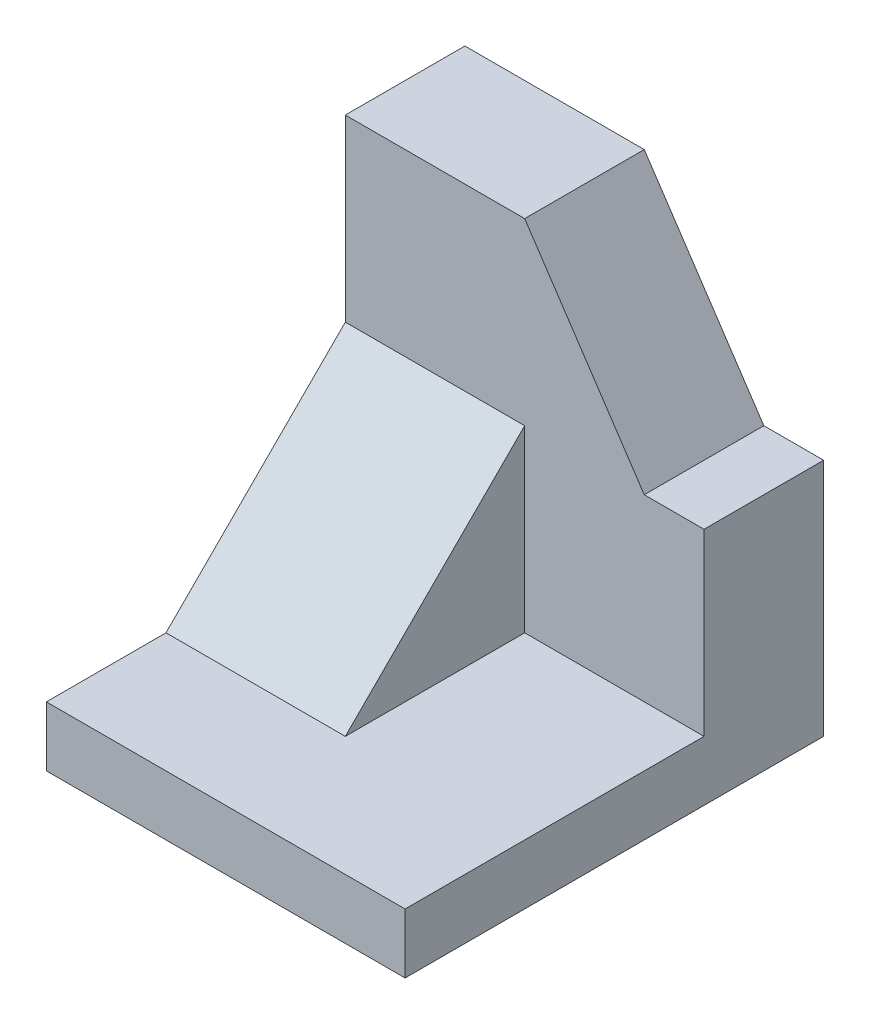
SolidWorks part; units mm, degrees
ref_plane "Alzado" through (0, 0, 0) normal (0, 0, 1) x (1, 0, 0)
ref_plane "Planta" through (0, 0, 0) normal (0, 1, 0) x (1, 0, 0)
ref_plane "Vista lateral" through (0, 0, 0) normal (1, 0, 0) x (0, 0, -1)
sketch "Croquis1" plane through (0, 0, 0) normal (0, 0, 1) x (1, 0, 0)
  line L0 (30, 35) -> (-30, -35) construction
  line L1 (-30, 35) -> (30, 35)
  line L2 (-30, 35) -> (-30, -35)
  line L3 (-30, -35) -> (30, -35)
  line L4 (30, 35) -> (30, -35)
  line L5 (30, -35) -> (-30, 35) construction
  dimension "D1" = 70
  dimension "D2" = 60
extrude "Saliente-Extruir1" add sketch "Croquis1" along normal mid plane 70
sketch "Croquis2" plane through (0, 0, 0) normal (1, 0, 0) x (0, 0, -1)
  line L0 (-35, -25) -> (-15, -25)
  line L1 (-35, 35) -> (35, 35) construction
  line L2 (15, 35) -> (15, 5)
  line L3 (-35, -35) -> (-35, 35) construction
  line L4 (-15, -25) -> (15, 5)
  line L5 (15, 35) -> (-35, 35)
  line L6 (-35, 35) -> (-35, -25)
  line L7 (-35, -35) -> (35, -35) construction
  line L8 (35, -35) -> (35, 35) construction
  dimension "D1" = 30
  dimension "D2" = 20
  dimension "D3" = 10
  dimension "D4" = 20
extrude "Cortar-Extruir1" cut sketch "Croquis2" against normal through all
sketch "Croquis3" plane through (0, 0, 0) normal (-1, 0, 0) x (0, 0, 1)
  line L0 (-15, 35) -> (35, 35) construction
  line L1 (35, 35) -> (-15, 35)
  line L2 (35, 35) -> (35, -25)
  line L3 (35, -25) -> (-15, -25)
  line L4 (-15, 35) -> (-15, -25)
  line L5 (35, 35) -> (35, -25) construction
  line L6 (-15, 5) -> (-15, 35) construction
  line L7 (35, -25) -> (15, -25) construction
extrude "Cortar-Extruir2" cut sketch "Croquis3" against normal through all
sketch "Croquis4" plane through (0, 0, -35) normal (0, 0, -1) x (-1, 0, 0)
  line L0 (0, 35) -> (-20, 5)
  line L1 (-30, 35) -> (30, 35) construction
  line L2 (-20, 5) -> (-30, 5)
  line L3 (-30, -35) -> (-30, 35) construction
  line L4 (-30, 5) -> (-30, 35)
  line L5 (-30, 35) -> (0, 35)
  dimension "D1" = 10
  dimension "D2" = 20
  dimension "D3" = 30
extrude "Cortar-Extruir3" cut sketch "Croquis4" against normal through all
